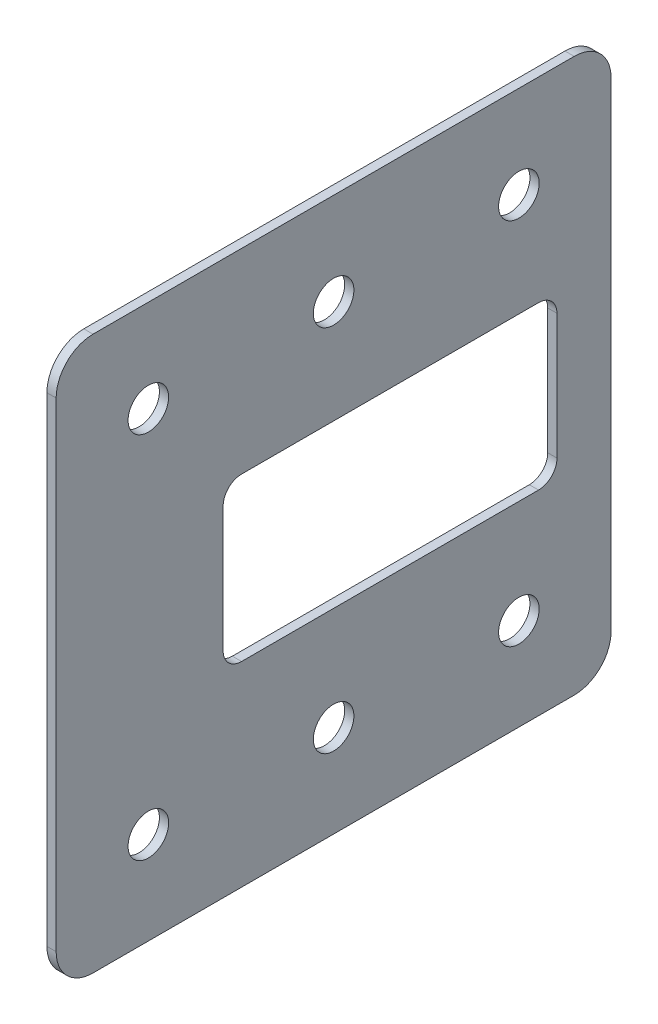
SolidWorks part; units mm, degrees
ref_plane "Płaszczyzna przednia" through (0, 0, 0) normal (0, 0, 1) x (1, 0, 0)
ref_plane "Płaszczyzna górna" through (0, 0, 0) normal (0, 1, 0) x (1, 0, 0)
ref_plane "Płaszczyzna prawa" through (0, 0, 0) normal (1, 0, 0) x (0, 0, -1)
body saved out of another part "Zapas-odkos dol —marka d-1"
